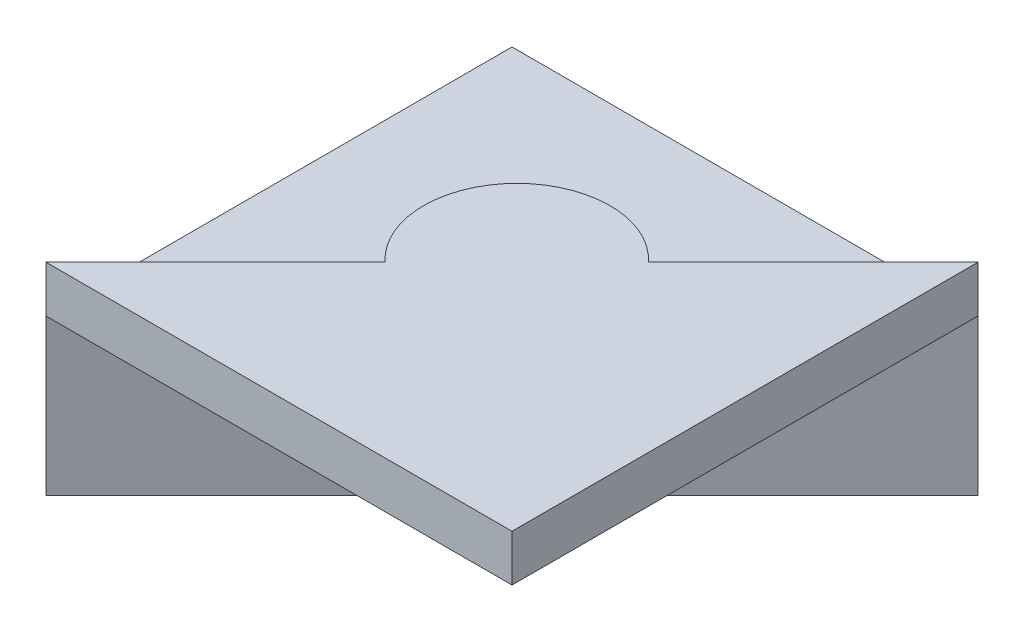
SolidWorks part; units mm, degrees
ref_plane "Front Plane" through (0, 0, 0) normal (0, 0, 1) x (1, 0, 0)
ref_plane "Top Plane" through (0, 0, 0) normal (0, 1, 0) x (1, 0, 0)
ref_plane "Right Plane" through (0, 0, 0) normal (1, 0, 0) x (0, 0, -1)
sketch "Sketch1" plane through (0, 0, 0) normal (0, 1, 0) x (1, 0, 0)
  line L0 (0, 0) -> (-30, 0)
  line L1 (-30, 0) -> (-30, -30)
  line L2 (-30, -30) -> (-19.0863, -19.0863)
  line L3 (-10.6066, -10.6066) -> (0, 0)
  arc A0 (-10.6066, -10.6066) -> (-19.0863, -19.0863) centre (-15, -14.6929) ccw
  dimension "D3" = 12
  dimension "D1" = 30
  dimension "D2" = 30
  dimension "D4" = 15
  dimension "D5" = 15
extrude "Extrude1" add sketch "Sketch1" along normal blind 10
sketch "Sketch4" plane through (0, 10, 0) normal (0, 1, 0) x (-1, 0, 0)
  line L0 (10.6066, 10.6066) -> (0, 0) construction
  line L1 (30, 30) -> (19.0863, 19.0863) construction
  line L2 (10.6066, 10.6066) -> (0, 0)
  line L3 (30, 30) -> (19.0863, 19.0863)
  line L4 (30, 30) -> (0, 30)
  line L5 (0, 30) -> (0, 0)
  arc A0 (10.6066, 10.6066) -> (19.0863, 19.0863) centre (15, 14.6929) ccw construction
  arc A1 (10.6066, 10.6066) -> (19.0863, 19.0863) centre (15, 14.6929) ccw
extrude "Extrude4" add sketch "Sketch4" along normal blind 3
